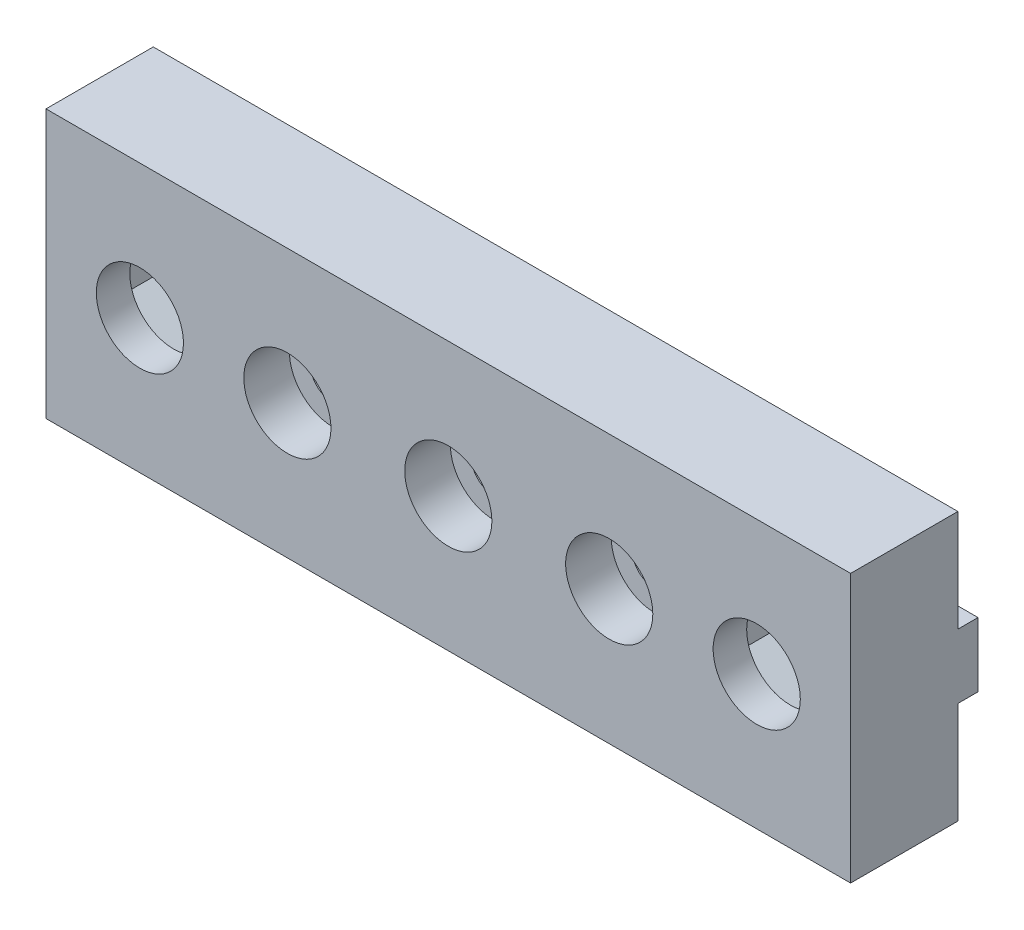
SolidWorks part; units mm, degrees
ref_plane "Ebene vorne" through (0, 0, 0) normal (0, 0, 1) x (1, 0, 0)
ref_plane "Ebene oben" through (0, 0, 0) normal (0, 1, 0) x (1, 0, 0)
ref_plane "Ebene rechts" through (0, 0, 0) normal (1, 0, 0) x (0, 0, -1)
sketch "Skizze1" plane through (0, 0, 0) normal (0, 0, 1) x (1, 0, 0)
  line L1 (-30, -10) -> (30, -10)
  line L2 (-30, -10) -> (-30, 10)
  line L3 (-30, 10) -> (30, 10)
  line L4 (30, -10) -> (30, 10)
  line L5 (-30, -10) -> (30, 10) construction
  line L6 (-30, 10) -> (30, -10) construction
  point P0 (0, 0)
  dimension "D1" = 20
  dimension "D2" = 60
extrude "Aufsatz-Linear austragen1" add sketch "Skizze1" along normal mid plane 8
sketch "Skizze4" plane through (0, 0, -4) normal (0, 0, -1) x (-1, 0, 0)
  line L0 (30, 10) -> (30, -10) construction
  line L1 (-30, -2.4) -> (30, -2.4)
  line L2 (-30, -2.4) -> (-30, 2.4)
  line L3 (-30, 2.4) -> (30, 2.4)
  line L4 (30, -2.4) -> (30, 2.4)
  line L5 (-30, -2.4) -> (30, 2.4) construction
  line L6 (-30, 2.4) -> (30, -2.4) construction
  point P0 (0, 0)
  dimension "D1" = 4.8
extrude "Aufsatz-Linear austragen2" add sketch "Skizze4" along normal mid plane 3
hole_wizard "Ø6.5 (6.5) Durchmesser Bohrung1" positions "Skizze2" profile "Skizze3" hole size "Ø6.5" standard "DIN"
sketch "Skizze2" plane through (0, 0, 4) normal (0, 0, 1) x (1, 0, 0)
  point P0 (-23, 0)
  point P2 (23, 0)
  dimension "D1" = 23
  dimension "D2" = 23
sketch "Skizze3" plane through (-23, 0, 4) normal (1, 0, 0) x (0, -1, 0)
  line L0 (0, 0) -> (0, 9.5)
  line L1 (0, 9.5) -> (3.25, 9.5)
  line L2 (3.25, 9.5) -> (3.25, 0)
  line L5 (3.25, 0) -> (0, 0)
  line L11 (0, -6.35) -> (0, 107.95) construction
  dimension "Bohrerdurchmesser" = 6.5
  dimension "Bohrungstiefe" = 9.5
sketch "Skizze5" plane through (0, 0, -4) normal (0, 0, -1) x (-1, 0, 0)
  line L1 (-23, 5.889) -> (-28.1, 2.9445)
  line L2 (-28.1, 2.9445) -> (-28.1, -2.9445)
  line L3 (-28.1, -2.9445) -> (-23, -5.889)
  line L4 (-23, -5.889) -> (-17.9, -2.9445)
  line L5 (-17.9, -2.9445) -> (-17.9, 2.9445)
  line L6 (-17.9, 2.9445) -> (-23, 5.889)
  line L7 (23, 5.889) -> (17.9, 2.9445)
  line L8 (17.9, 2.9445) -> (17.9, -2.9445)
  line L9 (17.9, -2.9445) -> (23, -5.889)
  line L10 (23, -5.889) -> (28.1, -2.9445)
  line L11 (28.1, -2.9445) -> (28.1, 2.9445)
  line L12 (28.1, 2.9445) -> (23, 5.889)
  circle A0 centre (-23, 0) radius 5.1 construction
  circle A1 centre (23, 0) radius 5.1 construction
  dimension "D1" = 10.2
extrude "Schnitt-Linear austragen1" cut sketch "Skizze5" against normal blind 5.5 and the other way through all
hole_wizard "Stirnsenkung für M3 Zylinderschraube mit Innensechskant1" positions "Skizze6" profile "Skizze7" counterbore size "M3" standard "DIN"
sketch "Skizze6" plane through (0, 0, 4) normal (0, 0, 1) x (1, 0, 0)
  point P0 (-12, 0)
  point P2 (0, 0)
  point P5 (12, 0)
  dimension "D1" = 12
  dimension "D2" = 12
sketch "Skizze7" plane through (-12, 0, 4) normal (1, 0, 0) x (0, -1, 0)
  line L0 (0, 0) -> (0, 9.5)
  line L1 (0, 9.5) -> (1.7, 9.5)
  line L3 (1.7, 9.5) -> (1.7, 3.4)
  line L4 (1.7, 3.4) -> (3.25, 3.4)
  line L5 (3.25, 3.4) -> (3.25, 0)
  line L7 (3.25, 0) -> (0, 0)
  line L11 (0, -6.35) -> (0, 107.95) construction
  dimension "Bohrerdurchmesser" = 3.4
  dimension "Bohrungstiefe" = 9.5
  dimension "Senkdurchmesser2" = 6.5
  dimension "Senktiefe2" = 3.4
